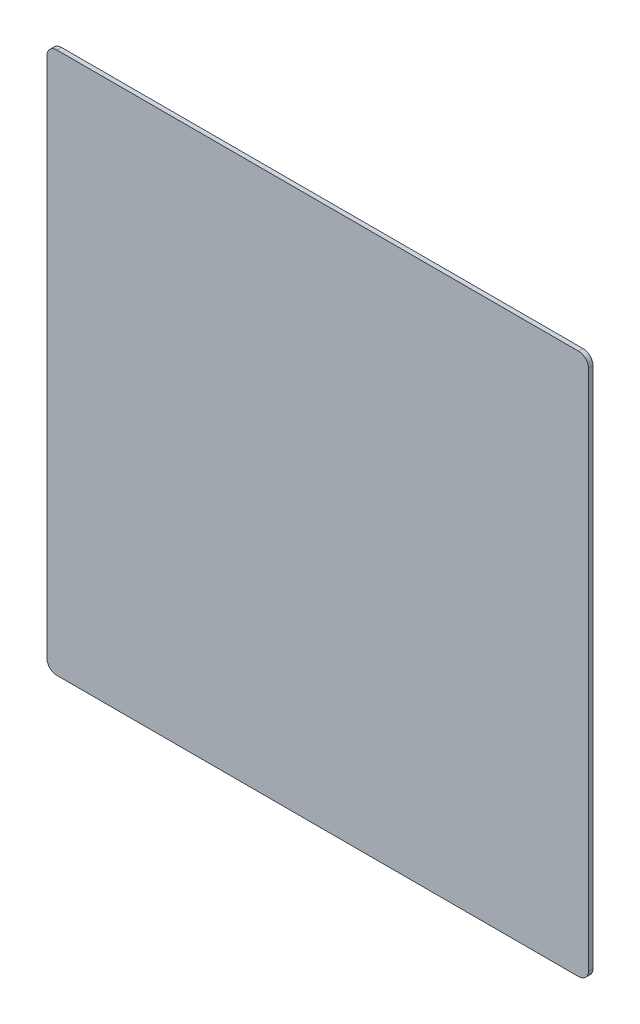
SolidWorks part; units mm, degrees
ref_plane "前视基准面" through (0, 0, 0) normal (0, 0, 1) x (1, 0, 0)
ref_plane "上视基准面" through (0, 0, 0) normal (0, 1, 0) x (1, 0, 0)
ref_plane "右视基准面" through (0, 0, 0) normal (1, 0, 0) x (0, 0, -1)
sketch "草图1" plane through (0, 0, 0) normal (0, 0, 1) x (1, 0, 0)
  line L1 (-289, -300) -> (289, -300)
  line L2 (-300, -289) -> (-300, 289)
  line L3 (-289, 300) -> (289, 300)
  line L4 (300, -289) -> (300, 289)
  line L5 (-300, -300) -> (300, 300) construction
  line L6 (-300, 300) -> (300, -300) construction
  arc A0 (289, 300) -> (300, 289) centre (289, 289) cw
  arc A1 (289, -300) -> (300, -289) centre (289, -289) ccw
  arc A2 (-289, -300) -> (-300, -289) centre (-289, -289) cw
  arc A3 (-300, 289) -> (-289, 300) centre (-289, 289) cw
  point P0 (0, 0)
  dimension "D3" = 11
  dimension "D1" = 600
  dimension "D2" = 600
extrude "凸台-拉伸1" add sketch "草图1" along normal blind 5
